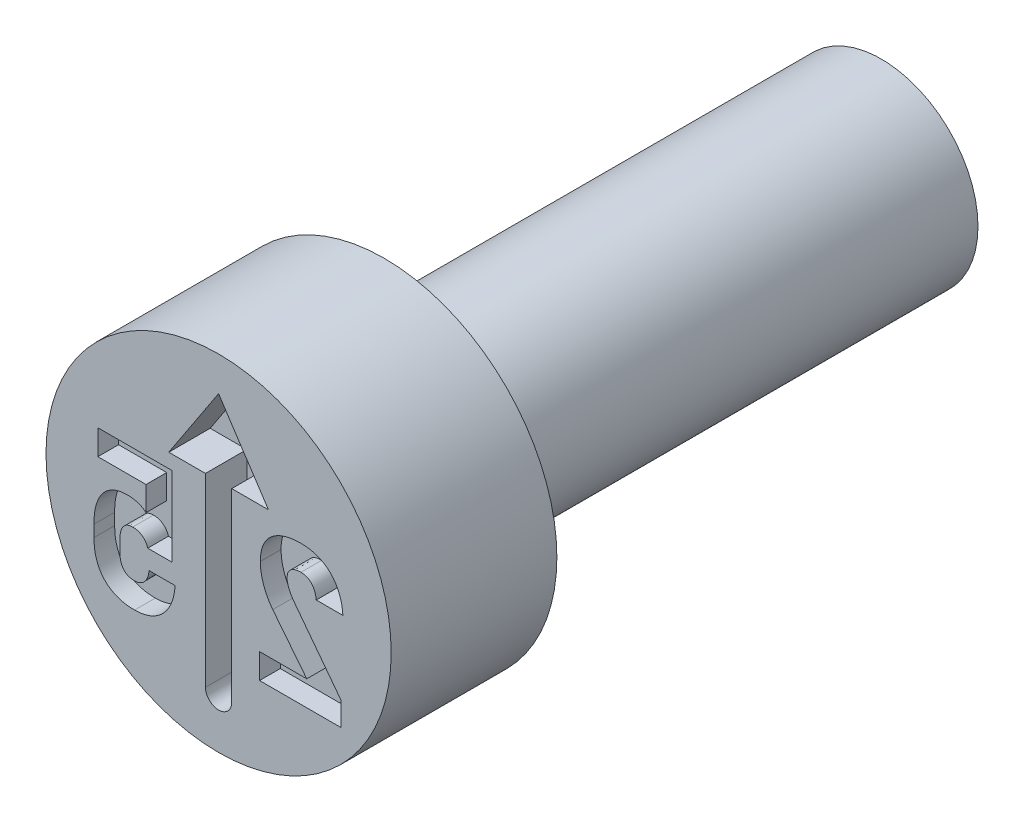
SolidWorks part; units mm, degrees
ref_plane "Front Plane" through (0, 0, 0) normal (0, 0, 1) x (1, 0, 0)
ref_plane "Top Plane" through (0, 0, 0) normal (0, 1, 0) x (1, 0, 0)
ref_plane "Right Plane" through (0, 0, 0) normal (1, 0, 0) x (0, 0, -1)
sketch "Sketch2" plane through (0, 0, 0) normal (1, 0, 0) x (0, 0, -1)
  line L0 (0.4039, 0) -> (50000.4039, 0) construction
  line L6 (0, 1.25) -> (0, 0)
  line L7 (1.2, 1.25) -> (0, 1.25)
  line L8 (1.2, 0.7) -> (1.2, 1.25)
  line L9 (4.8, 0.7) -> (1.2, 0.7)
  line L10 (4.8, 0) -> (4.8, 0.7)
  line L11 (0, 0) -> (4.8, 0)
  dimension "D1" = 2.5
  dimension "D2" = 1.4
  dimension "D3" = 4.8
  dimension "D4" = 1.2
revolve "Revolve1" add sketch "Sketch2" angle 360 about L0
sketch "Sketch3" plane through (0, 0, 0) normal (0, 0, 1) x (1, 0, 0)
  line L0 (0, 0) -> (0, 50000) construction
  line L1 (0.0952, 0.4532) -> (0.0952, -0.8881)
  line L2 (0.361, 0.4532) -> (0.0952, 0.4532)
  line L3 (0, 1.0011) -> (0.361, 0.4532)
  line L15 (0, 1.0011) -> (-0.361, 0.4532)
  line L16 (-0.361, 0.4532) -> (-0.0952, 0.4532)
  line L17 (-0.0952, 0.4532) -> (-0.0952, -0.8881)
  arc A2 (-0.0952, -0.8881) -> (0.0952, -0.8881) centre (0, -0.8881) ccw
extrude "Cut-Extrude4" cut sketch "Sketch3" against normal blind 0.3
sketch "Sketch4" plane through (0, 0, 0) normal (0, 0, 1) x (1, 0, 0)
  text T0 "2 5" font "Bahnschrift" height 1
  dimension "D1" = 0.65
extrude "Cut-Extrude5" cut sketch "Sketch4" against normal blind 0.15
